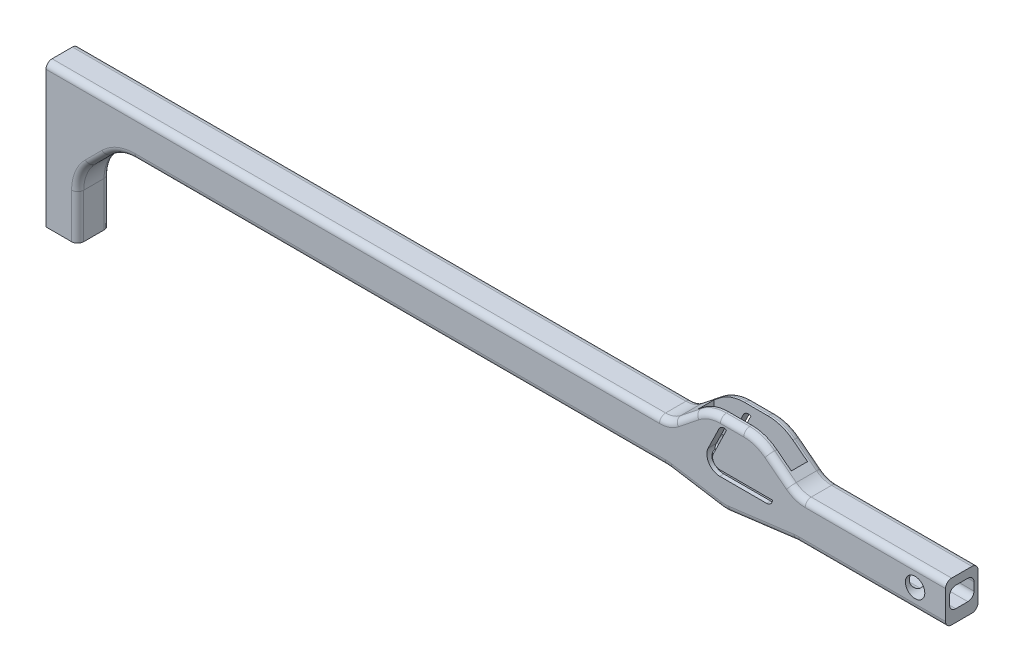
SolidWorks part; units mm, degrees
ref_plane "Plane1" through (0, 0, 0) normal (0, 0, 1) x (1, 0, 0)
ref_plane "Plane2" through (0, 0, 0) normal (0, 1, 0) x (1, 0, 0)
ref_plane "Plane3" through (0, 0, 0) normal (1, 0, 0) x (0, 0, -1)
sketch "Sketch1" plane through (0, 0, 0) normal (0, 0, 1) x (1, 0, 0)
  line L0 (-29.1428, -7) -> (-60.8728, -7)
  line L1 (-214.13, 7.5) -> (-60.8728, 7.5)
  line L2 (-48.3173, 12.2075) -> (-50.9822, 6.7315)
  line L3 (-36.5628, 2.16) -> (-48.1228, 2.16)
  line L4 (-45.7996, 10.9823) -> (-48.4645, 5.5063)
  line L5 (-36.5628, 4.96) -> (-48.1228, 4.96)
  line L6 (-36.5628, 3.56) -> (-48.1228, 3.56) construction
  line L7 (-49.7234, 6.1189) -> (-47.0585, 11.5949) construction
  line L8 (-206.33, -27.6417) -> (-214.13, -27.6417)
  line L9 (-214.13, -27.6417) -> (-214.13, 7.5)
  line L10 (-60.8728, 15) -> (-29.1428, 15)
  line L11 (-29.1428, 15) -> (-29.1428, 7.5)
  line L12 (-29.1428, 7.5) -> (7.5, 7.5)
  line L13 (7.5, 7.5) -> (7.5, -2.5)
  line L14 (7.5, -2.5) -> (-29.1428, -2.5)
  line L15 (-29.1428, -2.5) -> (-29.1428, -7)
  line L16 (-195.53, 0) -> (0, 0) construction
  line L17 (-60.8728, -7) -> (-60.8728, -2.5)
  line L18 (-60.8728, -2.5) -> (-206.33, -2.5)
  line L19 (-206.33, -2.5) -> (-206.33, -27.6417)
  line L20 (-60.8728, 7.5) -> (-60.8728, 15)
  line L21 (7.5, 2.5) -> (-10.9541, 2.5) construction
  circle A2 centre (0, 2.5) radius 2.39
  arc A3 (-50.9822, 6.7315) -> (-48.1228, 2.16) centre (-48.1228, 5.34) ccw
  arc A4 (-48.4645, 5.5063) -> (-48.1228, 4.96) centre (-48.1228, 5.34) ccw
  arc A5 (-36.5628, 2.16) -> (-36.5628, 4.96) centre (-36.5628, 3.56) ccw
  arc A6 (-45.7996, 10.9823) -> (-48.3173, 12.2075) centre (-47.0585, 11.5949) ccw
  dimension "D2" = 7.42
  dimension "D3" = 10.4956
  dimension "D6" = 1.4
  dimension "D10" = 3.18
  dimension "D20" = 221.63
  dimension "D11" = 11.56
  dimension "D15" = 7
  dimension "D22" = 4.78
  dimension "D4" = 64.05
  dimension "D5" = 8.0349
  dimension "D7" = 1.4
  dimension "D8" = 11.56
  dimension "D9" = 6.09
  dimension "D12" = 7.8
  dimension "D13" = 31.73
  dimension "D14" = 15
  dimension "D16" = 7.5
  dimension "D17" = 7.5
  dimension "D18" = 3.56
  dimension "D19" = 35.1417
  dimension "D21" = 10
extrude "Base-Extrude" add sketch "Sketch1" along normal mid plane 8
sketch "Sketch6" plane through (0, 0, 4) normal (0, 0, 1) x (1, 0, 0)
  line L0 (-29.1428, 7.5) -> (-36.0882, 12.8965)
  line L1 (-29.1428, 15) -> (-60.8728, 15) construction
  line L2 (-42.2237, 15) -> (-47.9714, 15)
  line L3 (-54.2077, 12.8172) -> (-60.8728, 7.5)
  line L4 (-29.1428, -2.5) -> (-46.8932, -4.7594)
  line L5 (-46.8932, -4.7594) -> (-60.8728, -2.5)
  line L6 (-29.1428, 7.5) -> (-29.1428, 13.6694)
  line L7 (-29.1428, 13.6694) -> (10.1471, 13.6694)
  line L8 (10.1471, 13.6694) -> (10.1471, -9.4467)
  line L9 (10.1471, -9.4467) -> (-29.1428, -9.4467)
  line L10 (-29.1428, -9.4467) -> (-29.1428, -2.5)
  line L11 (-60.8728, 7.5) -> (-60.8728, 21.9593)
  line L12 (-60.8728, 21.9593) -> (14.1326, 21.9593)
  line L13 (14.1326, 21.9593) -> (14.1326, -17.5772)
  line L14 (14.1326, -17.5772) -> (-60.8728, -17.5772)
  line L15 (-60.8728, -17.5772) -> (-60.8728, -2.5)
  arc A2 (-47.9714, 15) -> (-54.2077, 12.8172) centre (-47.9714, 5) ccw
  arc A3 (-36.0882, 12.8965) -> (-42.2237, 15) centre (-42.2237, 5) ccw
  point P19 (-51.4715, 15)
  point P22 (-38.7954, 15)
  dimension "D1" = 10
extrude "Cut-Extrude4" cut sketch "Sketch6" against normal through all
sketch "Sketch2" plane through (-214.13, 0, 0) normal (-1, 0, 0) x (0, 0, 1)
  line L8 (-3, 6.5) -> (-3, -26.6417)
  line L9 (-3, -26.6417) -> (3, -26.6417)
  line L10 (3, -26.6417) -> (3, 6.5)
  line L11 (3, 6.5) -> (-3, 6.5)
  line L12 (-3, 5.4691) -> (-3, 0.4691)
  line L13 (-3, 0.4691) -> (3, 0.4691)
  line L14 (3, 0.4691) -> (3, 5.4691)
  line L15 (3, 5.4691) -> (-3, 5.4691)
  dimension "D1" = 1
extrude "Cut-Extrude1" cut sketch "Sketch2" against normal through all
fillet "Fillet1" radius 6 2 edges at (-29.1428, 7.5, 0) (-60.8728, 7.5, 0)
fillet "Fillet3" radius 8 3 edges at (-29.1428, -2.5, 0) (-60.8728, -2.5, 0) (-46.8932, -4.7594, 0)
sketch "Sketch4" plane through (0, -27.6417, 0) normal (0, -1, 0) x (1, 0, 0)
  line L0 (-210.3031, 1.5) -> (-218.3031, 1.5)
  line L1 (-218.3031, 1.5) -> (-224.13, 0)
  line L2 (-224.13, 0) -> (-218.3031, -1.5)
  line L3 (-218.3031, -1.5) -> (-210.3031, -1.5)
  line L4 (-206.33, 0) -> (-224.13, 0) construction
  line L5 (-206.33, 4) -> (-206.33, -4) construction
  line L6 (-210.3031, 1.5) -> (-210.3031, -1.5)
  line L7 (-214.13, 4) -> (-214.13, -4) construction
  dimension "D1" = 3.8269
  dimension "D2" = 10
  dimension "D3" = 3
  dimension "D4" = 8
chamfer "Chamfer1" distance 10 angle 45 1 edges at (-206.33, -2.5, 0)
sketch "Sketch7" plane through (0, 0, 4) normal (0, 0, 1) x (1, 0, 0)
  line L0 (-48.1228, 3.56) -> (-35.1628, 3.56)
  line L2 (-46.4458, 12.8537) -> (-49.7234, 6.1189)
  line L3 (-48.3173, 12.2075) -> (-50.9822, 6.7315) construction
  line L4 (-35.1628, 3.56) -> (-35.1628, 7.3628)
  line L5 (-35.1628, 7.3628) -> (-46.4458, 12.8537)
  arc A0 (-36.5628, 2.16) -> (-36.5628, 4.96) centre (-36.5628, 3.56) ccw construction
  arc A1 (-45.7996, 10.9823) -> (-48.3173, 12.2075) centre (-47.0585, 11.5949) ccw construction
  arc A4 (-49.7234, 6.1189) -> (-48.1228, 3.56) centre (-48.1228, 5.34) ccw
  arc A5 (-49.7234, 6.1189) -> (-48.1228, 3.56) centre (-48.1228, 5.34) ccw
  arc A6 (-50.9822, 6.7315) -> (-48.1228, 2.16) centre (-48.1228, 5.34) ccw construction
  dimension "D3" = 1.4
extrude "mid_slot_feature" add sketch "Sketch7" against normal up to surface (8 mm away)
sketch "Sketch3" plane through (0, 15, 0) normal (0, 1, 0) x (-1, 0, 0)
  line L0 (42.2237, -4) -> (47.9714, -4) construction
  line L1 (55.5, -2) -> (32.5, -2)
  line L2 (55.5, -2) -> (55.5, 2)
  line L3 (55.5, 2) -> (32.5, 2)
  line L4 (32.5, -2) -> (32.5, 2)
  line L5 (-7.5, 4) -> (-7.5, -4) construction
  dimension "D1" = 2
  dimension "D2" = 4
  dimension "D3" = 23
  dimension "D4" = 40
extrude "Cut-Extrude2" cut sketch "Sketch3" against normal blind 20
extrude "Cut-Extrude5" cut sketch "Sketch4" against normal blind 27
fillet "Fillet4" radius 1.5 10 edges at (-51.3002, 5.4691, -2.5) (-132.7151, 5.4691, -3) (-107.695, 0.4691, 3) (-132.7151, 5.4691, 3) (-107.695, 0.4691, -3) (-51.3002, 5.4691, 2.5) (-53.4001, 5.4691, -2) (-44, 0.4691, -2) (-53.4001, 5.4691, 2) (-44, 0.4691, 2)
fillet "Fillet5" radius 1.5 8 edges at (-13.8314, 5.4691, -3) (-13.8314, 5.4691, 3) (4.38, 0.4691, 3) (4.38, 0.4691, -3) (-35.1628, 5.4691, 2.5) (-35.1628, 5.4691, -2.5) (-33.8314, 5.4691, -2) (-33.8314, 5.4691, 2)
fillet "Fillet6" radius 1.5 9 edges at (-9.7929, 7.5, -4) (-138.5515, 7.5, -4) (-56.7194, 10.8134, -4) (-29.0316, 7.8243, -4) (-60.9907, 7.8369, -4) (-45.0976, 15, -4) (-33.4277, 10.8293, -4) (-38.9807, 14.4595, -4) (-51.275, 14.4385, -4)
fillet "Fillet7" radius 1.5 9 edges at (-138.5515, 7.5, 4) (-56.7194, 10.8134, 4) (-29.0316, 7.8243, 4) (-60.9907, 7.8369, 4) (-9.7929, 7.5, 4) (-45.0976, 15, 4) (-38.9807, 14.4595, 4) (-33.4277, 10.8293, 4) (-51.275, 14.4385, 4)
fillet "Fillet8" radius 10 2 edges at (-196.33, -2.5, 0) (-206.33, -12.5, 0)
fillet "Fillet10" radius 1.5 22 edges at (-206.33, -22.1419, -4) (-10.5679, -2.5, -4) (-10.5679, -2.5, 4) (-37.6965, -3.5888, 4) (-37.6965, -3.5888, -4) (-54.1362, -3.5888, 4) (-54.1362, -3.5888, -4) (-46.8918, -4.6765, 4) (-46.8918, -4.6765, -4) (-29.1418, -2.516, -4) (-29.1418, -2.516, 4) (-60.8749, -2.5257, -4) (-60.8749, -2.5257, 4) (-206.33, -22.1419, 4) (-201.33, -7.5, 4) (-201.33, -7.5, -4) (-126.8515, -2.5, 4) (-126.8515, -2.5, -4) (-205.5688, -12.8153, 4) (-205.5688, -12.8153, -4) (-196.0147, -3.2612, -4) (-196.0147, -3.2612, 4)
sketch "Sketch8" [suppressed] plane through (0, 0, 4) normal (0, 0, 1) x (1, 0, 0)
  circle A0 centre (0, 2.5) radius 2.39 construction
  point P0 (0, 2.5)
sketch "Sketch9" [suppressed] plane through (0, 0, 4) normal (0, 0, 1) x (1, 0, 0)
  line L0 (-48.3173, 12.2075) -> (-50.9822, 6.7315) construction
  line L1 (-48.1228, 2.16) -> (-36.5628, 2.16) construction
  line L2 (-36.5628, 4.96) -> (-48.1228, 4.96) construction
  line L3 (-48.4645, 5.5063) -> (-45.7996, 10.9823) construction
  line L4 (-48.3173, 12.2075) -> (-50.9822, 6.7315) construction
  line L5 (-48.1228, 2.16) -> (-36.5628, 2.16) construction
  line L6 (-36.5628, 4.96) -> (-48.1228, 4.96) construction
  line L7 (-48.4645, 5.5063) -> (-45.7996, 10.9823) construction
  line L8 (-48.1228, 2.17) -> (-36.5628, 2.17)
  line L9 (-36.5628, 4.95) -> (-48.1228, 4.95)
  line L10 (-48.4735, 5.5107) -> (-45.8086, 10.9866)
  line L11 (-48.3083, 12.2031) -> (-50.9732, 6.7271)
  line L12 (-48.3263, 12.2119) -> (-50.9912, 6.7359)
  line L13 (-48.1228, 2.15) -> (-36.5628, 2.15)
  line L14 (-36.5628, 4.97) -> (-48.1228, 4.97)
  line L15 (-48.4555, 5.5019) -> (-45.7906, 10.9779)
  arc A0 (-45.7996, 10.9823) -> (-48.3173, 12.2075) centre (-47.0585, 11.5949) ccw construction
  arc A1 (-50.9822, 6.7315) -> (-48.1228, 2.16) centre (-48.1228, 5.34) ccw construction
  arc A2 (-36.5628, 2.16) -> (-36.5628, 4.96) centre (-36.5628, 3.56) ccw construction
  arc A3 (-48.4645, 5.5063) -> (-48.1228, 4.96) centre (-48.1228, 5.34) ccw construction
  arc A4 (-45.7996, 10.9823) -> (-48.3173, 12.2075) centre (-47.0585, 11.5949) ccw construction
  arc A5 (-50.9822, 6.7315) -> (-48.1228, 2.16) centre (-48.1228, 5.34) ccw construction
  arc A6 (-36.5628, 2.16) -> (-36.5628, 4.96) centre (-36.5628, 3.56) ccw construction
  arc A7 (-48.4645, 5.5063) -> (-48.1228, 4.96) centre (-48.1228, 5.34) ccw construction
  arc A8 (-50.9732, 6.7271) -> (-48.1228, 2.17) centre (-48.1228, 5.34) ccw
  arc A9 (-36.5628, 2.17) -> (-36.5628, 4.95) centre (-36.5628, 3.56) ccw
  arc A10 (-48.4735, 5.5107) -> (-48.1228, 4.95) centre (-48.1228, 5.34) ccw
  arc A11 (-45.8086, 10.9866) -> (-48.3083, 12.2031) centre (-47.0585, 11.5949) ccw
  arc A12 (-50.9912, 6.7359) -> (-48.1228, 2.15) centre (-48.1228, 5.34) ccw
  arc A13 (-36.5628, 2.15) -> (-36.5628, 4.97) centre (-36.5628, 3.56) ccw
  arc A14 (-48.4555, 5.5019) -> (-48.1228, 4.97) centre (-48.1228, 5.34) ccw
  arc A15 (-45.7906, 10.9779) -> (-48.3263, 12.2119) centre (-47.0585, 11.5949) ccw
  dimension "D1" = 0.01
  dimension "D2" = 0.01
extrude "Extrude1" [suppressed] add sketch "Sketch9" against normal up to vertex
